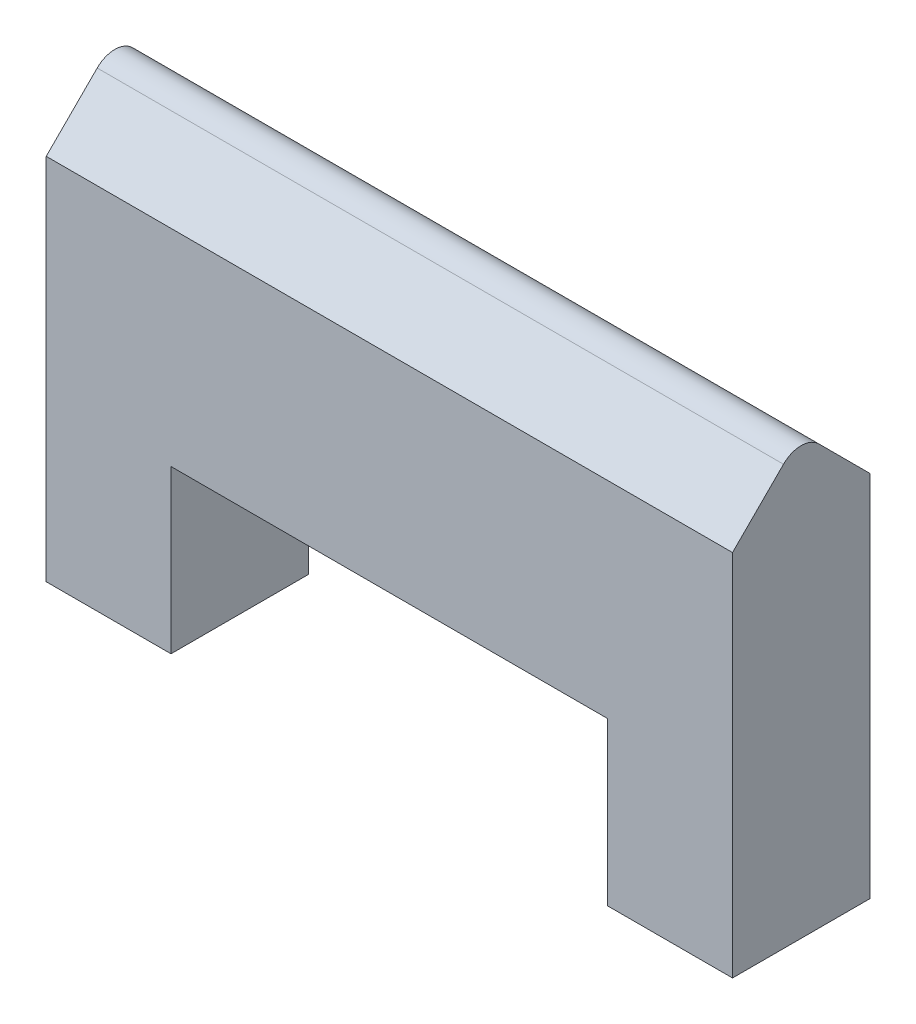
SolidWorks part; units mm, degrees
ref_plane "Plan de face" through (0, 0, 0) normal (0, 0, 1) x (1, 0, 0)
ref_plane "Plan de dessus" through (0, 0, 0) normal (0, 1, 0) x (1, 0, 0)
ref_plane "Plan de droite" through (0, 0, 0) normal (1, 0, 0) x (0, 0, -1)
sketch "Esquisse1" plane through (0, 0, 0) normal (0, 0, 1) x (1, 0, 0)
  line L0 (45, 0) -> (55, 0)
  line L1 (0, 0) -> (10, 0)
  line L2 (0, 0) -> (0, 35)
  line L3 (0, 35) -> (55, 35)
  line L4 (55, 0) -> (55, 35)
  line L6 (10, 0) -> (10, 13)
  line L7 (10, 13) -> (45, 13)
  line L8 (45, 0) -> (45, 13)
  dimension "D1" = 55
  dimension "D2" = 35
  dimension "D3" = 10
  dimension "D4" = 35
  dimension "D5" = 13
extrude "Extrusion1" add sketch "Esquisse1" along normal mid plane 11
hole_wizard "Diamètre du perçage Ø5.0 (5)1" positions "Esquisse3" profile "Esquisse2" hole size "Ø5.0" standard "ISO"
sketch "Esquisse3" plane through (0, 13, 0) normal (0, -1, 0) x (1, 0, 0)
  line L0 (10, 5.5) -> (10, -5.5) construction
  line L1 (10, 5.5) -> (45, 5.5) construction
  point P0 (27.5, 0)
  dimension "D1" = 17.5
  dimension "D2" = 5.5
sketch "Esquisse2" plane through (27.5, 13, 0) normal (1, 0, 0) x (0, 0, -1)
  line L0 (0, 0) -> (0, 11.5022)
  line L1 (0, 11.5022) -> (2.5, 10)
  line L2 (2.5, 10) -> (2.5, 0)
  line L5 (2.5, 0) -> (0, 0)
  line L10 (0, 11.5022) -> (-2.5, 10) construction
  line L11 (0, -6.35) -> (0, 107.95) construction
  dimension "Diamètre du perçage" = 5
  dimension "Profondeur du perçage" = 10
  dimension "Angle de pointe" = 118
sketch "Esquisse4" plane through (55, 0, 0) normal (1, 0, 0) x (0, 0, -1)
  line L0 (-5.5, 0) -> (5.5, 0) construction
  line L1 (-1.4142, 33.6142) -> (-5.5, 29.5284)
  line L3 (-5.5, 0) -> (-5.5, 35) construction
  line L4 (-5.5, 29.5284) -> (-5.5, 36.3222)
  line L5 (-5.5, 36.3222) -> (5.5, 36.3222)
  line L6 (5.5, 36.3222) -> (5.5, 29.5284)
  line L7 (5.5, 0) -> (5.5, 35) construction
  line L8 (5.5, 29.5284) -> (1.4142, 33.6142)
  arc A0 (1.4142, 33.6142) -> (-1.4142, 33.6142) centre (0, 32.2) ccw
  dimension "D1" = 4
  dimension "D2" = 32.2
  dimension "D3" = 45
  dimension "D4" = 45
extrude "Enlèv. mat.-Extru.1" cut sketch "Esquisse4" against normal through all
